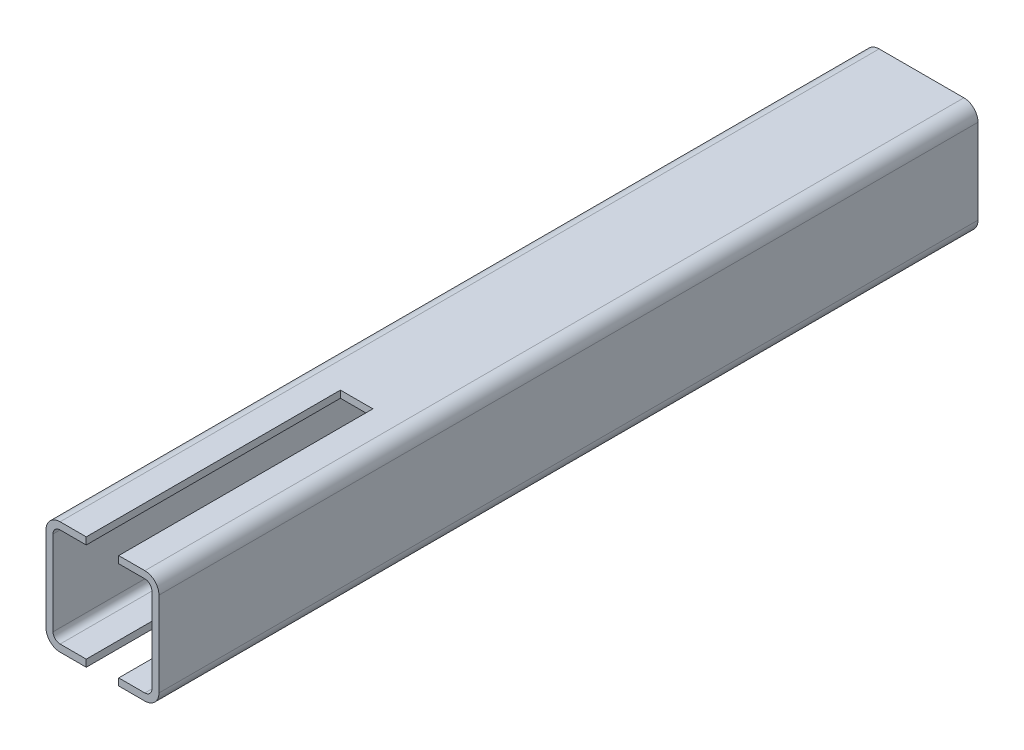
SolidWorks part; units mm, degrees
ref_plane "Front Plane" through (0, 0, 0) normal (1, 0, 0) x (0, 1, 0)
ref_plane "Top Plane" through (0, 0, 0) normal (0, 0, 1) x (0, 1, 0)
ref_plane "Right Plane" through (0, 0, 0) normal (0, 1, 0) x (-1, 0, 0)
sketch "6in beam" plane through (0, 0, 0) normal (0, 0, 1) x (0, 1, 0)
  line B0 (-76.2, -88.9) -> (76.2, -88.9)
  line B1 (-88.9, -76.2) -> (-88.9, 76.2)
  line B2 (76.2, 88.9) -> (-76.2, 88.9)
  line B3 (88.9, 76.2) -> (88.9, -76.2)
  line B4 (-76.2, -101.6) -> (76.2, -101.6)
  line B5 (-101.6, -76.2) -> (-101.6, 76.2)
  line B6 (76.2, 101.6) -> (-76.2, 101.6)
  line B7 (101.6, 76.2) -> (101.6, -76.2)
  arc B8 (101.6, 76.2) -> (76.2, 101.6) centre (76.2, 76.2) ccw
  arc B9 (76.2, -101.6) -> (101.6, -76.2) centre (76.2, -76.2) ccw
  arc B10 (-101.6, -76.2) -> (-76.2, -101.6) centre (-76.2, -76.2) ccw
  arc B11 (-76.2, 101.6) -> (-101.6, 76.2) centre (-76.2, 76.2) ccw
  arc B12 (-76.2, 88.9) -> (-88.9, 76.2) centre (-76.2, 76.2) ccw
  arc B13 (88.9, 76.2) -> (76.2, 88.9) centre (76.2, 76.2) ccw
  arc B14 (76.2, -88.9) -> (88.9, -76.2) centre (76.2, -76.2) ccw
  arc B15 (-88.9, -76.2) -> (-76.2, -88.9) centre (-76.2, -76.2) ccw
sketch_block_instance "8x8x0.5-1"
sketch_block "8x8x0.5" parameters "D1"=25.4, "D2"=12.7, "D3"=12.7, "D4"=12.7, "D5"=203.2, "D6"=203.2, "D7"=177.8, "D8"=177.8
extrude "Beam 6in" add sketch "6in beam" along normal blind 152.4 and the other way blind 1320.8
sketch "sk cross" plane through (0, 0, 0) normal (0, 0, 1) x (0, -1, 0)
  line L0 (111.25, 27.815) -> (-111.25, -27.815) construction
  point P2 (0, 0)
  line B0 (111.25, 27.815) -> (111.25, -27.815)
  line B1 (111.25, -27.815) -> (-111.25, -27.815)
  line B2 (-111.25, -27.815) -> (-111.25, 27.815)
  line B3 (-111.25, 27.815) -> (111.25, 27.815)
sketch_block_instance "Cross base sk-1"
sketch_block "Cross base sk"
sketch "Sketch1" plane through (0, 0, 152.4) normal (0, 0, 1) x (1, 0, 0)
  line L1 (-29.21, 160.402) -> (29.21, 160.402)
  line L2 (-29.21, 160.402) -> (-29.21, -149.3936)
  line L3 (-29.21, -149.3936) -> (29.21, -149.3936)
  line L4 (29.21, 160.402) -> (29.21, -149.3936)
  point P4 (0, 160.402)
  dimension "D1" = 58.42
extrude "Cut-Extrude1" cut sketch "Sketch1" against normal blind 457.2
